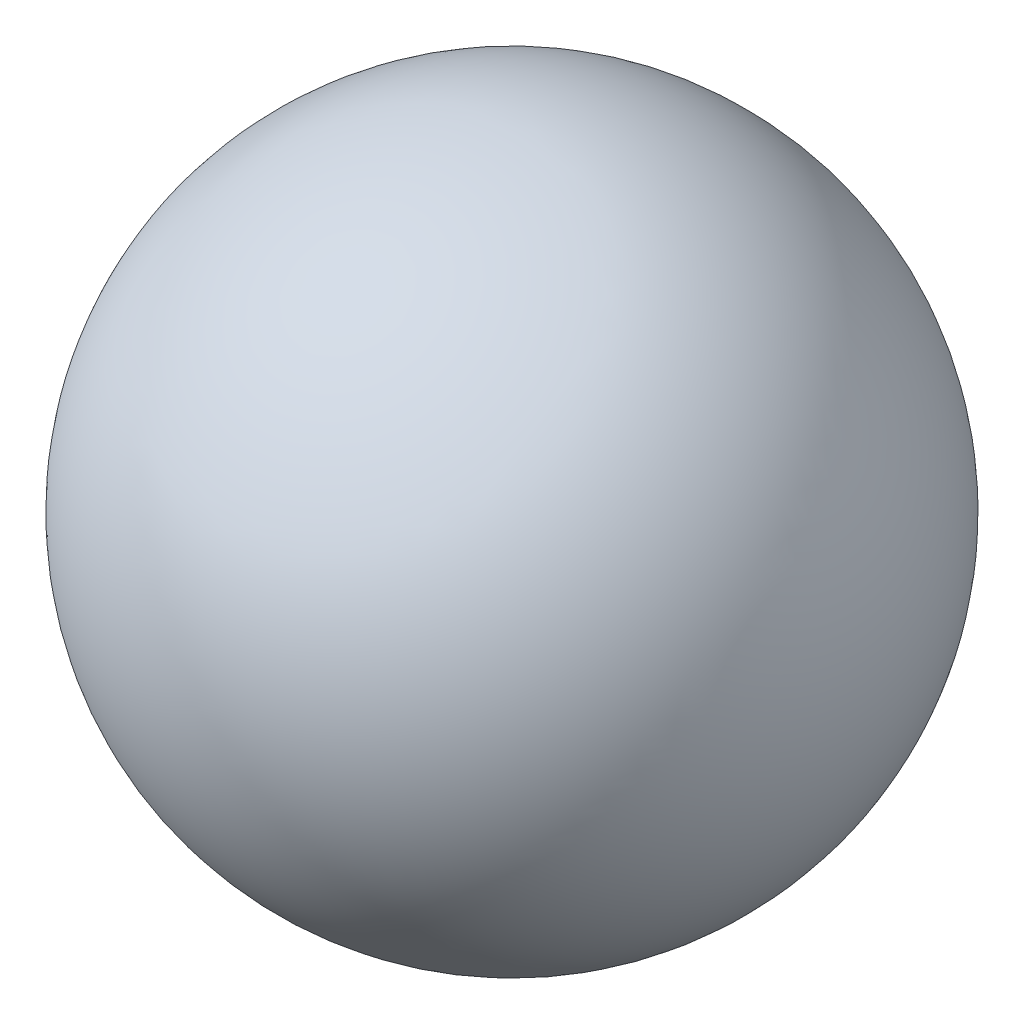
SolidWorks part; units mm, degrees
ref_plane "Front Plane" through (0, 0, 0) normal (0, 0, 1) x (1, 0, 0)
ref_plane "Top Plane" through (0, 0, 0) normal (0, 1, 0) x (1, 0, 0)
ref_plane "Right Plane" through (0, 0, 0) normal (1, 0, 0) x (0, 0, -1)
sketch "Sketch1" plane through (0, 0, 0) normal (0, 0, 1) x (1, 0, 0)
  line L0 (-3.9, 0) -> (3.9, 0)
  line L1 (-13.4966, 0) -> (13.4122, 0) construction
  arc A0 (-3.9, 0) -> (3.9, 0) centre (0, 0) cw
  point P3 (0, 0)
  dimension "D1" = 7.8
revolve "Revolve1" add sketch "Sketch1" angle 360 about L1
